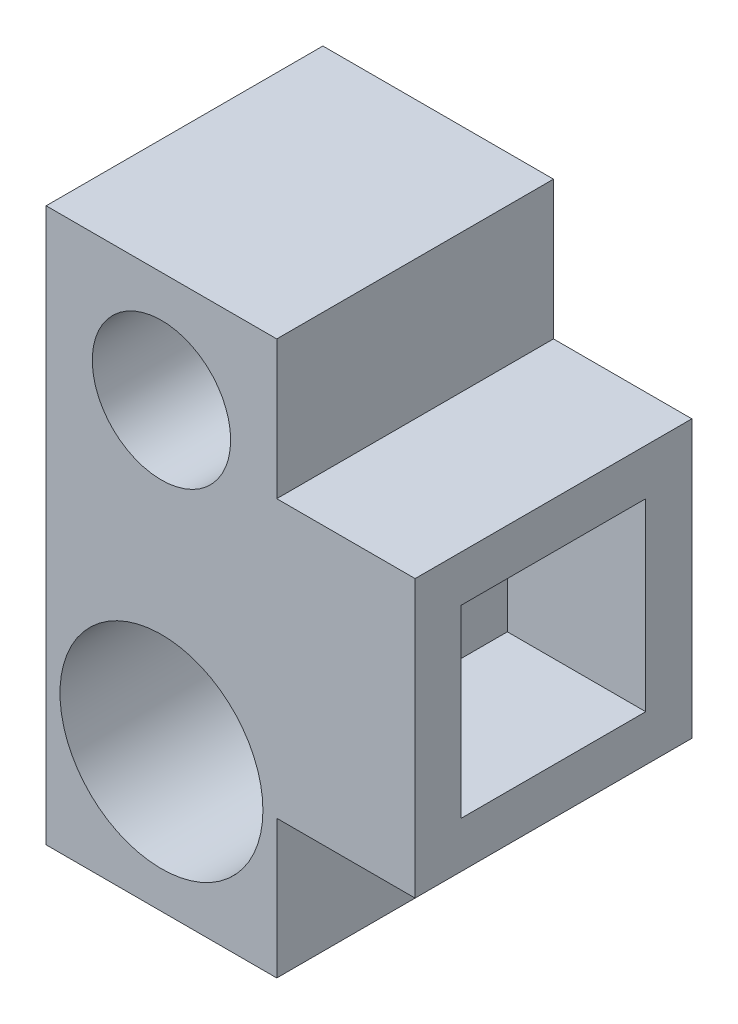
SolidWorks part; units mm, degrees
other "<Unionmedia>-<Boss-Extrude4>"
ref_plane "Alzado" through (0, 0, 0) normal (0, 0, 1) x (1, 0, 0)
ref_plane "Planta" through (0, 0, 0) normal (0, 1, 0) x (1, 0, 0)
ref_plane "Vista lateral" through (0, 0, 0) normal (1, 0, 0) x (0, 0, -1)
inserted part "Unionmedia"
sketch "Sketch2" plane through (-22.8072, 0, 0) normal (1, 0, 0) x (0, 0, -1)
  line L0 (-26, -67.0782) -> (-26, -15.0782) construction
  line L1 (26, -67.0782) -> (-26, -67.0782)
  line L2 (26, -67.0782) -> (26, -20.0782)
  line L3 (15, -20.0782) -> (-15, -20.0782)
  line L4 (-26, -67.0782) -> (-26, -20.0782)
  line L5 (26, -15.0782) -> (26, -67.0782) construction
  line L6 (26, -67.0782) -> (-26, -67.0782) construction
  line L9 (15, -20.0782) -> (21, -20.0782) construction
  line L11 (26, -15.0782) -> (15, -15.0782)
  line L12 (26, -15.0782) -> (26, -20.0782)
  line L14 (15, -15.0782) -> (15, -20.0782)
  line L15 (-26, -15.0782) -> (-15, -15.0782)
  line L16 (-26, -15.0782) -> (-26, -20.0782)
  line L18 (-15, -15.0782) -> (-15, -20.0782)
extrude "Cut-Extrude1" cut sketch "Sketch2" against normal blind 10
